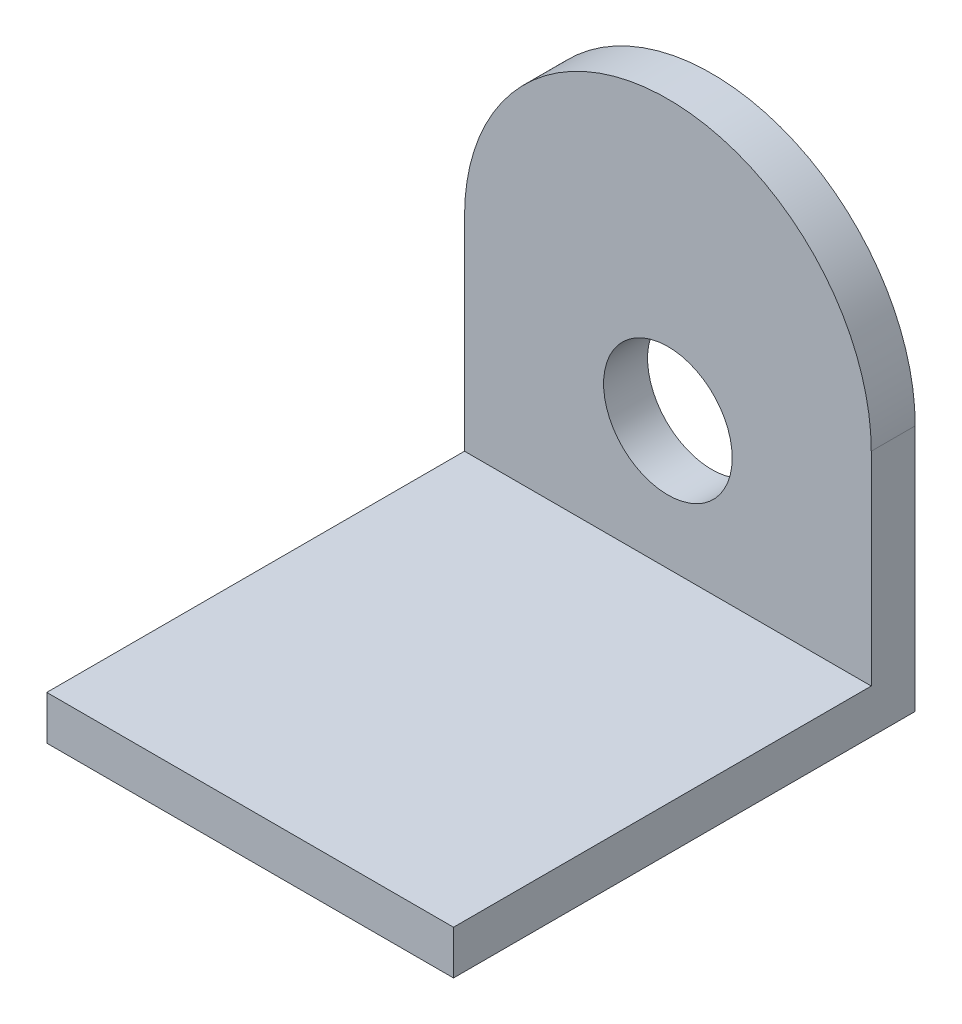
SolidWorks part; units mm, degrees
ref_plane "Front Plane" through (0, 0, 0) normal (0, 0, 1) x (1, 0, 0)
ref_plane "Top Plane" through (0, 0, 0) normal (0, 1, 0) x (1, 0, 0)
ref_plane "Right Plane" through (0, 0, 0) normal (1, 0, 0) x (0, 0, -1)
sketch "Sketch1" plane through (0, 0, 0) normal (0, 0, 1) x (1, 0, 0)
  line L0 (-27.6104, -18.5) -> (-27.6104, -22.5) construction
  line L3 (-46.1104, -22.5) -> (-9.1104, -22.5)
  line L5 (-55.2208, 32.3799) -> (0, -22.5) construction
  line L6 (-55.2208, -22.5) -> (0, 32.3799) construction
  line L7 (-9.1104, 0) -> (0, 0) construction
  line L8 (-46.1104, 0) -> (-55.2208, 0) construction
  line L9 (-27.6104, 18.5) -> (-27.6104, 32.3799) construction
  line L10 (-27.6104, -18.5) -> (-27.6104, -12.7) construction
  line L11 (-46.1104, 0) -> (-46.1104, -22.5)
  line L12 (-9.1104, 0) -> (-9.1104, -22.5)
  arc A0 (-9.1104, 0) -> (-46.1104, 0) centre (-27.6104, 0) ccw
  circle A1 centre (-27.6104, -6.85) radius 5.85
  point P2 (-27.6104, 4.94)
  dimension "D1" = 37
  dimension "D2" = 11.7
  dimension "D3" = 5.8
  dimension "D4" = 4
extrude "Boss-Extrude1" add sketch "Sketch1" along normal blind 4
sketch "Sketch2" plane through (0, 0, 0) normal (0, 0, 1) x (1, 0, 0)
  line L0 (-9.1104, -22.5) -> (-9.1104, 0) construction
  line L1 (-46.1104, -22.5) -> (-9.1104, -22.5)
  line L2 (-46.1104, -22.5) -> (-46.1104, -18.5)
  line L3 (-46.1104, -18.5) -> (-9.1104, -18.5)
  line L4 (-9.1104, -22.5) -> (-9.1104, -18.5)
  dimension "D1" = 4
extrude "Boss-Extrude2" add sketch "Sketch2" along normal blind 42
